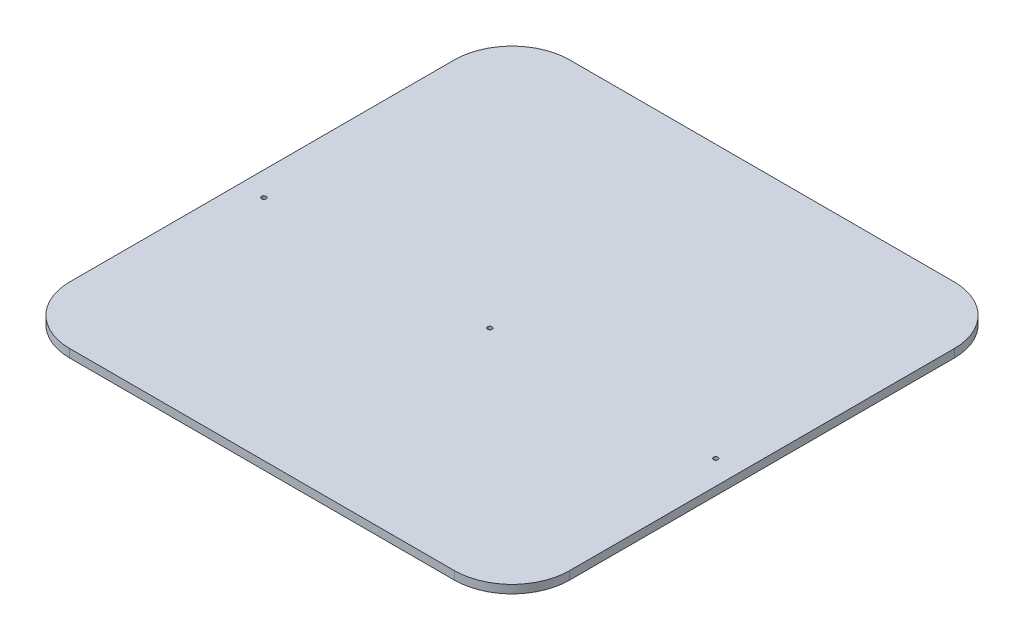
SolidWorks part; units mm, degrees
ref_plane "Front Plane" through (0, 0, 0) normal (0, 0, 1) x (1, 0, 0)
ref_plane "Top Plane" through (0, 0, 0) normal (0, 1, 0) x (1, 0, 0)
ref_plane "Right Plane" through (0, 0, 0) normal (1, 0, 0) x (0, 0, -1)
sketch "Sketch1" plane through (0, 0, 0) normal (0, 1, 0) x (1, 0, 0)
  line L0 (-266.7, 0) -> (0, 0) construction
  line L1 (-203.2, 266.7) -> (203.2, 266.7) construction
  line L2 (-266.7, 203.2) -> (-266.7, -203.2) construction
  line L3 (-203.2, -266.7) -> (203.2, -266.7) construction
  line L4 (266.7, 203.2) -> (266.7, -203.2) construction
  line L5 (0, 0) -> (0, 266.7) construction
  line L6 (264.16, 203.2) -> (264.16, -203.2)
  line L7 (-203.2, -264.16) -> (203.2, -264.16)
  line L8 (-264.16, 203.2) -> (-264.16, -203.2)
  line L9 (-203.2, 264.16) -> (203.2, 264.16)
  arc A0 (203.2, 266.7) -> (266.7, 203.2) centre (203.2, 203.2) cw construction
  arc A1 (203.2, -266.7) -> (266.7, -203.2) centre (203.2, -203.2) ccw construction
  arc A2 (-266.7, -203.2) -> (-203.2, -266.7) centre (-203.2, -203.2) ccw construction
  arc A3 (-203.2, 266.7) -> (-266.7, 203.2) centre (-203.2, 203.2) ccw construction
  arc A4 (203.2, -264.16) -> (264.16, -203.2) centre (203.2, -203.2) ccw
  arc A5 (-264.16, -203.2) -> (-203.2, -264.16) centre (-203.2, -203.2) ccw
  arc A6 (-203.2, 264.16) -> (-264.16, 203.2) centre (-203.2, 203.2) ccw
  arc A7 (203.2, 264.16) -> (264.16, 203.2) centre (203.2, 203.2) cw
  dimension "D1" = 63.5
  dimension "D2" = 533.4
  dimension "D3" = 2.54
extrude "Boss-Extrude1" add sketch "Sketch1" along normal blind 8.7312
sketch "Sketch2" plane through (0, 8.7312, 0) normal (0, 1, 0) x (1, 0, 0)
  circle A0 centre (-238.76, -23.4156) radius 2.3813 construction
  circle A1 centre (-238.76, -23.4156) radius 2.3813
  circle A2 centre (0, -23.4156) radius 2.3813 construction
  circle A3 centre (0, -23.4156) radius 2.3813
  circle A4 centre (238.76, -23.4156) radius 2.3813 construction
  circle A5 centre (238.76, -23.4156) radius 2.3813
extrude "Cut-Extrude1" cut sketch "Sketch2" against normal through all
